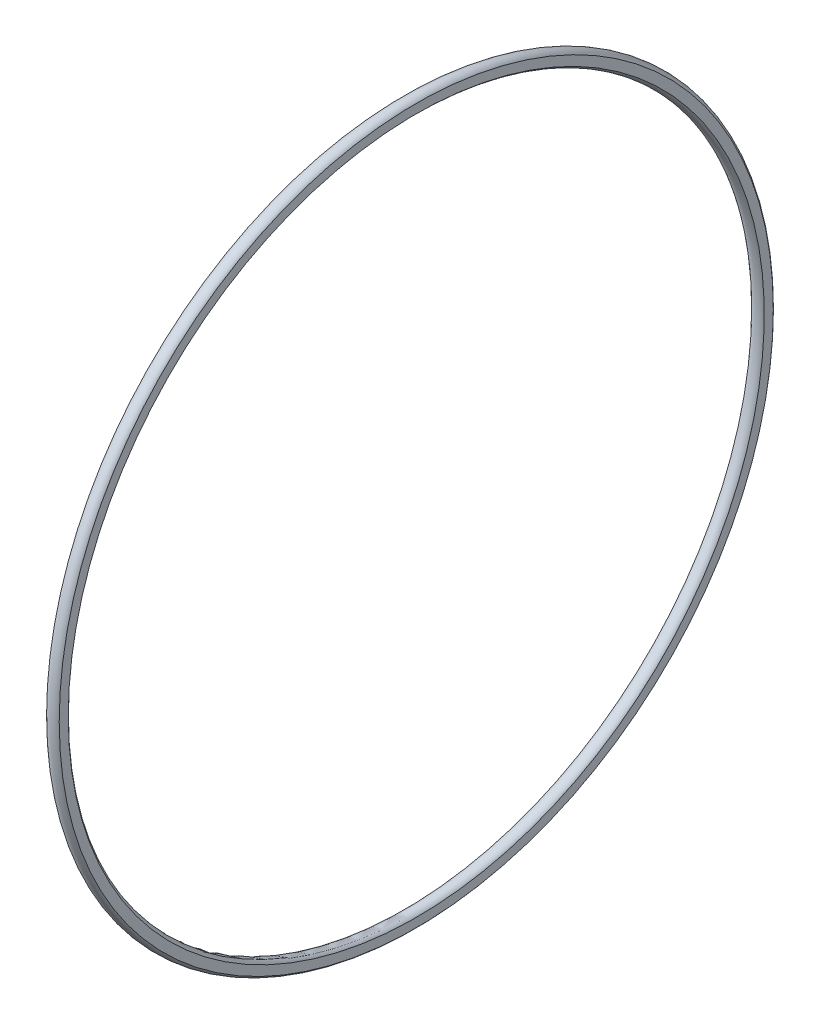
SolidWorks part; units mm, degrees
ref_plane "Face" through (0, 0, 0) normal (0, 0, 1) x (1, 0, 0)
ref_plane "Dessus" through (0, 0, 0) normal (0, 1, 0) x (1, 0, 0)
ref_plane "Droite" through (0, 0, 0) normal (1, 0, 0) x (0, 0, -1)
sketch "Esquisse1" plane through (0, 0, 0) normal (0, 0, 1) x (1, 0, 0)
  line L0 (0, 0) -> (28.3308, 0) construction
  circle A0 centre (11.5835, 68.5) radius 1.5
  dimension "D1" = 3
  dimension "D2" = 137
revolve "Révolution1" add sketch "Esquisse1" angle 360 about L0
ref_plane "Plan1" through (10.5, 0, 0) normal (1, 0, 0) x (0, 0, -1)
sketch "Esquisse2" plane through (10.5, 0, 0) normal (1, 0, 0) x (0, 0, -1)
  line L1 (85.6129, 122.271) -> (-86.8295, 122.271)
  line L2 (85.6129, 122.271) -> (85.6129, -122.1384)
  line L3 (85.6129, -122.1384) -> (-86.8295, -122.1384)
  line L4 (-86.8295, 122.271) -> (-86.8295, -122.1384)
extrude "Enlèv. mat.-Extru.1" cut sketch "Esquisse2" against normal blind 10
ref_plane "Plan2" through (12.8, 0, 0) normal (1, 0, 0) x (0, 0, -1)
sketch "Esquisse3" plane through (12.8, 0, 0) normal (1, 0, 0) x (0, 0, -1)
  line L1 (-101.7372, 75.0342) -> (88.5649, 75.0342)
  line L2 (-101.7372, 75.0342) -> (-101.7372, -86.8412)
  line L3 (-101.7372, -86.8412) -> (88.5649, -86.8412)
  line L4 (88.5649, 75.0342) -> (88.5649, -86.8412)
extrude "Enlèv. mat.-Extru.2" cut sketch "Esquisse3" along normal blind 10
